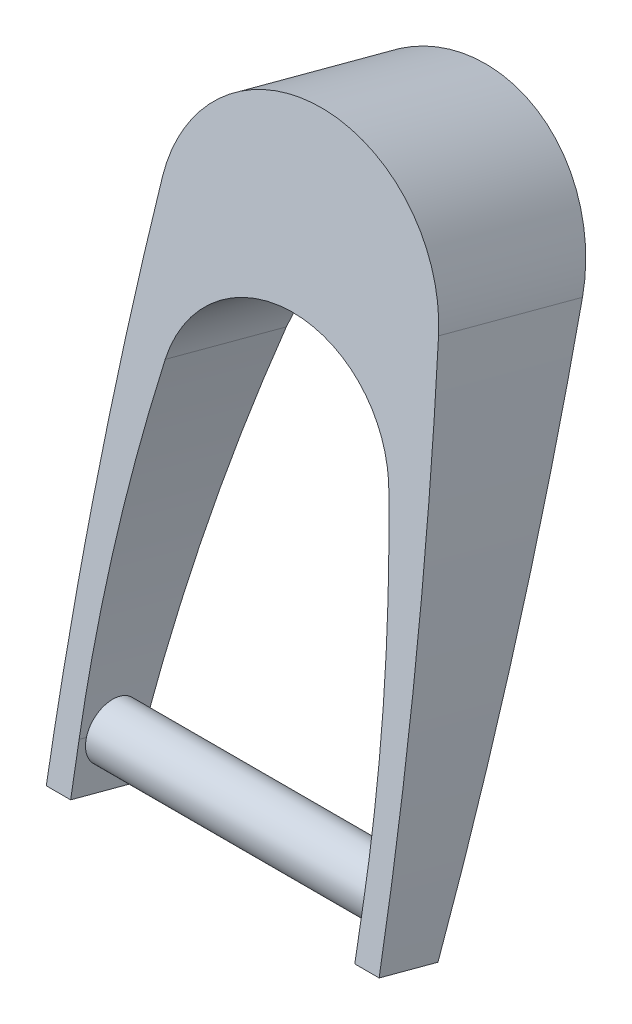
SolidWorks part; units mm, degrees
ref_plane "Front Plane" through (0, 0, 0) normal (0, 0, 1) x (1, 0, 0)
ref_plane "Top Plane" through (0, 0, 0) normal (0, 1, 0) x (1, 0, 0)
ref_plane "Right Plane" through (0, 0, 0) normal (1, 0, 0) x (0, 0, -1)
sketch "Sketch1" plane through (0, 0, 0) normal (0, 0, 1) x (1, 0, 0)
  line L0 (0, 197.8969) -> (0, -120.2566) construction
  line L1 (-74.71, 0) -> (75.6174, 0) construction
  line L2 (-35, 0) -> (-35, -12.4243)
  line L3 (-35, -12.4243) -> (-41, -12.4243)
  line L4 (-69.4835, 146.5328) -> (0, 146.5328) construction
  line L5 (-23.1893, -12.4243) -> (-62.1197, -12.4243) construction
  line L6 (35, -12.4243) -> (41, -12.4243)
  line L7 (35, 0) -> (35, -12.4243)
  arc A0 (-41, -12.4243) -> (-34, 116.0465) centre (1141.4102, -12.4243) cw
  arc A1 (-34, 116.0465) -> (34, 116.0465) centre (0, 112.3303) cw
  arc A2 (-35, 0) -> (-27.5354, 81.6123) centre (414.8766, 0) cw
  arc A3 (-27.5354, 81.6123) -> (27.5354, 81.6123) centre (0, 76.5328) cw
  arc A4 (18, 76.5328) -> (-18, 76.5328) centre (0, 76.5328) ccw construction
  arc A5 (-25, -6.6853) -> (-23.1893, -12.4243) centre (-15, -6.6853) ccw construction
  arc A6 (35, 0) -> (27.5354, 81.6123) centre (-414.8766, 0) ccw
  arc A7 (41, -12.4243) -> (34, 116.0465) centre (-1141.4102, -12.4243) ccw
  arc A8 (18, 76.5328) -> (-18, 76.5328) centre (0, 76.5328) ccw construction
  point P11 (34, 130.2246)
  point P16 (0, 0)
  point P17 (-24.6133, -9.4392)
  point P18 (-23.1893, -12.4243)
  point P36 (5.8113, 140.3604)
  dimension "D2" = 70
  dimension "D1" = 10
  dimension "D3" = 6
  dimension "D4" = 35
  dimension "D5" = 34
ref_plane "Plane1" through (0, 0, 0) normal (0, 0.2588, 0.9659) x (1, 0, 0)
sketch "Sketch2" plane through (0, 0, 0) normal (0, 0.2588, 0.9659) x (1, 0, 0)
  line L4 (-35, -12.0009) -> (-35, 0)
  line L5 (-41, -12.0009) -> (-35, -12.0009)
  line L6 (35, -12.0009) -> (41, -12.0009)
  line L7 (35, 0) -> (35, -12.0009)
  line L8 (-35, -12.0009) -> (-35, 0)
  line L9 (-41, -12.0009) -> (-35, -12.0009)
  line L10 (35, -12.0009) -> (41, -12.0009)
  line L11 (35, 0) -> (35, -12.0009)
  ellipse E6 centre (-414.8766, 0) end of major axis (-864.7532, 0) minor radius 434.5474 (35, 0) -> (27.5354, 78.8314) ccw
  ellipse E7 centre (0, 73.925) end of major axis (28, 73.925) minor radius 27.0459 (27.5354, 78.8314) -> (-27.5354, 78.8314) ccw
  ellipse E8 centre (414.8766, 0) end of major axis (864.7532, 0) minor radius 434.5474 (-27.5354, 78.8314) -> (-35, 0) ccw
  ellipse E9 centre (1141.4102, -12.0009) end of major axis (2323.8204, -12.0009) minor radius 1142.1205 (-34, 112.0923) -> (-41, -12.0009) ccw
  ellipse E10 centre (0, 108.5028) end of major axis (34.2025, 108.5028) minor radius 33.0371 (34, 112.0923) -> (-34, 112.0923) ccw
  ellipse E11 centre (-1141.4102, -12.0009) end of major axis (-2323.8204, -12.0009) minor radius 1142.1205 (41, -12.0009) -> (34, 112.0923) ccw
  ellipse E12 centre (-414.8766, 0) end of major axis (-864.7532, 0) minor radius 434.5474 (35, 0) -> (27.5354, 78.8314) ccw
  ellipse E13 centre (0, 73.925) end of major axis (28, 73.925) minor radius 27.0459 (27.5354, 78.8314) -> (-27.5354, 78.8314) ccw
  ellipse E14 centre (414.8766, 0) end of major axis (864.7532, 0) minor radius 434.5474 (-27.5354, 78.8314) -> (-35, 0) ccw
  ellipse E15 centre (1141.4102, -12.0009) end of major axis (2323.8204, -12.0009) minor radius 1142.1205 (-34, 112.0923) -> (-41, -12.0009) ccw
  ellipse E16 centre (0, 108.5028) end of major axis (-34.2025, 108.5028) minor radius 33.0371 (34, 112.0923) -> (-34, 112.0923) ccw
  ellipse E17 centre (-1141.4102, -12.0009) end of major axis (-2323.8204, -12.0009) minor radius 1142.1205 (41, -12.0009) -> (34, 112.0923) ccw
  dimension "D1" = 0
extrude "Boss-Extrude1" add sketch "Sketch2" along normal mid plane 15
sketch "Sketch3" plane through (0, 0, 0) normal (1, 0, 0) x (0, 0, -1)
  circle A0 centre (0, 0) radius 6.6853 construction
  circle A1 centre (0, 0) radius 6.6853
extrude "Boss-Extrude2" add sketch "Sketch3" along normal mid plane 75
draft "Draft3" type of draft neutral plane draft angle 5 faces to draft 2 parameters "D1"=5
